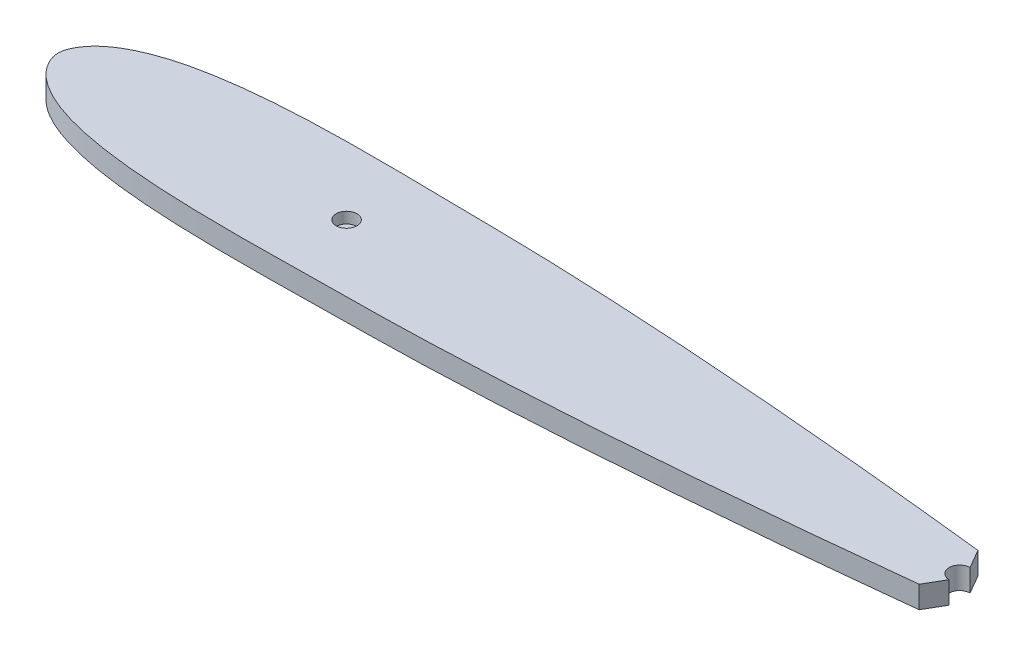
SolidWorks part; units mm, degrees
ref_plane "Front Plane" through (0, 0, 0) normal (0, 0, 1) x (1, 0, 0)
ref_plane "Top Plane" through (0, 0, 0) normal (0, 1, 0) x (1, 0, 0)
ref_plane "Right Plane" through (0, 0, 0) normal (1, 0, 0) x (0, 0, -1)
sketch "Sketch1" plane through (0, 0, 0) normal (0, 1, 0) x (1, 0, 0)
  line L0 (71.9303, -9.0513) -> (71.9519, -9.0647)
  spline S0 degree 3 poles (71.9303, -9.0513) (68.7966, -8.6196) (63.0003, -7.8147) (54.5308, -6.7346) (46.5307, -5.7653) (35.8673, -4.5512) (25.2004, -3.4392) (14.5302, -2.4363) (6.5301, -1.7484) (-1.4698, -1.1236) (-9.5232, -0.5726) (-17.5764, -0.1011) (-25.6304, 0.248) (-33.6309, 0.506) (-40.2465, 0.5015) (-45.5257, 0.6244) (-52.1392, 0.7165) (-60.1464, 0.7205) (-68.1529, 0.2977) (-73.2186, -0.2662) (-76.6922, -0.8358) (-79.361, -1.4431) (-81.4881, -2.0862) (-83.098, -2.6746) (-84.7173, -3.4124) (-86.3653, -4.3792) (-87.7324, -5.5098) (-88.9364, -7.0232) (-89.8227, -9.0595) (-88.9364, -11.0958) (-87.7324, -12.6092) (-86.3653, -13.7398) (-84.7173, -14.7066) (-83.098, -15.4444) (-81.4881, -16.0328) (-79.361, -16.6759) (-76.6922, -17.2832) (-73.2186, -17.8528) (-68.1529, -18.4167) (-60.1464, -18.8395) (-52.1392, -18.8355) (-45.5257, -18.7434) (-40.2465, -18.6205) (-33.6309, -18.625) (-25.6304, -18.367) (-17.5764, -18.0179) (-9.5232, -17.5464) (-1.4698, -16.9954) (6.5301, -16.3706) (14.5302, -15.6827) (25.2004, -14.6798) (35.8673, -13.5678) (46.5307, -12.3536) (54.5308, -11.3844) (63.0075, -10.3033) (68.8109, -9.4974) (71.9519, -9.0647) knots -0.004321 -0.004321 -0.004321 -0.004321 0.024634 0.049243 0.07383 0.098397 0.147479 0.171995 0.196494 0.220976 0.245442 0.27038 0.294813 0.319232 0.343642 0.35536 0.367566 0.404183 0.428636 0.44092 0.450818 0.460843 0.465946 0.471149 0.476523 0.482208 0.488618 0.492568 0.5 0.507432 0.511382 0.517792 0.523477 0.528851 0.534054 0.539157 0.549182 0.55908 0.571364 0.595817 0.632434 0.64464 0.656358 0.680768 0.705187 0.72962 0.754558 0.779024 0.803506 0.828005 0.852521 0.901603 0.92617 0.950757 0.975366 1.004387 1.004387 1.004387 1.004387
  point P0 (71.9303, -9.0513)
extrude "Boss-Extrude1" add sketch "Sketch1" along normal blind 3.175
sketch "Sketch2" plane through (0, 3.175, 0) normal (0, 1, 0) x (1, 0, 0)
  line L0 (71.9303, -9.0513) -> (-89.4725, -9.0513) construction
  circle A0 centre (39.9303, -9.0513) radius 1.5
  spline S0 degree 3 poles (71.9303, -9.0513) (68.7966, -8.6196) (63.0003, -7.8147) (54.5308, -6.7346) (46.5307, -5.7653) (35.8673, -4.5512) (25.2004, -3.4392) (14.5302, -2.4363) (6.5301, -1.7484) (-1.4698, -1.1236) (-9.5232, -0.5726) (-17.5764, -0.1011) (-25.6304, 0.248) (-33.6309, 0.506) (-40.2465, 0.5015) (-45.5257, 0.6244) (-52.1392, 0.7165) (-60.1464, 0.7205) (-68.1529, 0.2977) (-73.2186, -0.2662) (-76.6922, -0.8358) (-79.361, -1.4431) (-81.4881, -2.0862) (-83.098, -2.6746) (-84.7173, -3.4124) (-86.3653, -4.3792) (-87.7324, -5.5098) (-88.9364, -7.0232) (-89.8227, -9.0595) (-88.9364, -11.0958) (-87.7324, -12.6092) (-86.3653, -13.7398) (-84.7173, -14.7066) (-83.098, -15.4444) (-81.4881, -16.0328) (-79.361, -16.6759) (-76.6922, -17.2832) (-73.2186, -17.8528) (-68.1529, -18.4167) (-60.1464, -18.8395) (-52.1392, -18.8355) (-45.5257, -18.7434) (-40.2465, -18.6205) (-33.6309, -18.625) (-25.6304, -18.367) (-17.5764, -18.0179) (-9.5232, -17.5464) (-1.4698, -16.9954) (6.5301, -16.3706) (14.5302, -15.6827) (25.2004, -14.6798) (35.8673, -13.5678) (46.5307, -12.3536) (54.5308, -11.3844) (63.0075, -10.3033) (68.8109, -9.4974) (71.9519, -9.0647) knots -0.004321 -0.004321 -0.004321 -0.004321 0.024634 0.049243 0.07383 0.098397 0.147479 0.171995 0.196494 0.220976 0.245442 0.27038 0.294813 0.319232 0.343642 0.35536 0.367566 0.404183 0.428636 0.44092 0.450818 0.460843 0.465946 0.471149 0.476523 0.482208 0.488618 0.492568 0.5 0.507432 0.511382 0.517792 0.523477 0.528851 0.534054 0.539157 0.549182 0.55908 0.571364 0.595817 0.632434 0.64464 0.656358 0.680768 0.705187 0.72962 0.754558 0.779024 0.803506 0.828005 0.852521 0.901603 0.92617 0.950757 0.975366 1.004387 1.004387 1.004387 1.004387 construction
  dimension "D1" = 3
  dimension "D2" = 32
extrude "Cut-Extrude1" cut sketch "Sketch2" against normal blind 3.175
sketch "Sketch3" plane through (0, 3.175, 0) normal (0, 1, 0) x (1, 0, 0)
  line L0 (71.9519, -9.0647) -> (-89.4726, -9.0647) construction
  circle A0 centre (-48.0481, -9.0647) radius 1.5
  spline S0 degree 3 poles (71.9303, -9.0513) (68.7966, -8.6196) (63.0003, -7.8147) (54.5308, -6.7346) (46.5307, -5.7653) (35.8673, -4.5512) (25.2004, -3.4392) (14.5302, -2.4363) (6.5301, -1.7484) (-1.4698, -1.1236) (-9.5232, -0.5726) (-17.5764, -0.1011) (-25.6304, 0.248) (-33.6309, 0.506) (-40.2465, 0.5015) (-45.5257, 0.6244) (-52.1392, 0.7165) (-60.1464, 0.7205) (-68.1529, 0.2977) (-73.2186, -0.2662) (-76.6922, -0.8358) (-79.361, -1.4431) (-81.4881, -2.0862) (-83.098, -2.6746) (-84.7173, -3.4124) (-86.3653, -4.3792) (-87.7324, -5.5098) (-88.9364, -7.0232) (-89.8227, -9.0595) (-88.9364, -11.0958) (-87.7324, -12.6092) (-86.3653, -13.7398) (-84.7173, -14.7066) (-83.098, -15.4444) (-81.4881, -16.0328) (-79.361, -16.6759) (-76.6922, -17.2832) (-73.2186, -17.8528) (-68.1529, -18.4167) (-60.1464, -18.8395) (-52.1392, -18.8355) (-45.5257, -18.7434) (-40.2465, -18.6205) (-33.6309, -18.625) (-25.6304, -18.367) (-17.5764, -18.0179) (-9.5232, -17.5464) (-1.4698, -16.9954) (6.5301, -16.3706) (14.5302, -15.6827) (25.2004, -14.6798) (35.8673, -13.5678) (46.5307, -12.3536) (54.5308, -11.3844) (63.0075, -10.3033) (68.8109, -9.4974) (71.9519, -9.0647) knots -0.004321 -0.004321 -0.004321 -0.004321 0.024634 0.049243 0.07383 0.098397 0.147479 0.171995 0.196494 0.220976 0.245442 0.27038 0.294813 0.319232 0.343642 0.35536 0.367566 0.404183 0.428636 0.44092 0.450818 0.460843 0.465946 0.471149 0.476523 0.482208 0.488618 0.492568 0.5 0.507432 0.511382 0.517792 0.523477 0.528851 0.534054 0.539157 0.549182 0.55908 0.571364 0.595817 0.632434 0.64464 0.656358 0.680768 0.705187 0.72962 0.754558 0.779024 0.803506 0.828005 0.852521 0.901603 0.92617 0.950757 0.975366 1.004387 1.004387 1.004387 1.004387 construction
  dimension "D2" = 3
  dimension "D1" = 120
extrude "Cut-Extrude2" cut sketch "Sketch3" against normal blind 1.5875
sketch "Sketch4" plane through (0, 0, 0) normal (0, -1, 0) x (1, 0, 0)
  line L0 (71.9303, 9.0513) -> (-89.4725, 9.0513) construction
  circle A0 centre (-73.2697, 9.0513) radius 1.5
  circle A1 centre (39.9303, 9.0513) radius 1.5 construction
  spline S0 degree 3 poles (71.9303, 9.0513) (68.7966, 8.6196) (63.0003, 7.8147) (54.5308, 6.7346) (46.5307, 5.7653) (35.8673, 4.5512) (25.2004, 3.4392) (14.5302, 2.4363) (6.5301, 1.7484) (-1.4698, 1.1236) (-9.5232, 0.5726) (-17.5764, 0.1011) (-25.6304, -0.248) (-33.6309, -0.506) (-40.2465, -0.5015) (-45.5257, -0.6244) (-52.1392, -0.7165) (-60.1464, -0.7205) (-68.1529, -0.2977) (-73.2186, 0.2662) (-76.6922, 0.8358) (-79.361, 1.4431) (-81.4881, 2.0862) (-83.098, 2.6746) (-84.7173, 3.4124) (-86.3653, 4.3792) (-87.7324, 5.5098) (-88.9364, 7.0232) (-89.8227, 9.0595) (-88.9364, 11.0958) (-87.7324, 12.6092) (-86.3653, 13.7398) (-84.7173, 14.7066) (-83.098, 15.4444) (-81.4881, 16.0328) (-79.361, 16.6759) (-76.6922, 17.2832) (-73.2186, 17.8528) (-68.1529, 18.4167) (-60.1464, 18.8395) (-52.1392, 18.8355) (-45.5257, 18.7434) (-40.2465, 18.6205) (-33.6309, 18.625) (-25.6304, 18.367) (-17.5764, 18.0179) (-9.5232, 17.5464) (-1.4698, 16.9954) (6.5301, 16.3706) (14.5302, 15.6827) (25.2004, 14.6798) (35.8673, 13.5678) (46.5307, 12.3536) (54.5308, 11.3844) (63.0075, 10.3033) (68.8109, 9.4974) (71.9519, 9.0647) knots -0.004321 -0.004321 -0.004321 -0.004321 0.024634 0.049243 0.07383 0.098397 0.147479 0.171995 0.196494 0.220976 0.245442 0.27038 0.294813 0.319232 0.343642 0.35536 0.367566 0.404183 0.428636 0.44092 0.450818 0.460843 0.465946 0.471149 0.476523 0.482208 0.488618 0.492568 0.5 0.507432 0.511382 0.517792 0.523477 0.528851 0.534054 0.539157 0.549182 0.55908 0.571364 0.595817 0.632434 0.64464 0.656358 0.680768 0.705187 0.72962 0.754558 0.779024 0.803506 0.828005 0.852521 0.901603 0.92617 0.950757 0.975366 1.004387 1.004387 1.004387 1.004387 construction
  dimension "D2" = 3
  dimension "D1" = 113.2
extrude "Cut-Extrude3" cut sketch "Sketch4" against normal blind 1.5875
sketch "Sketch5" plane through (0, 3.175, 0) normal (0, 1, 0) x (1, 0, 0)
  line L0 (39.9303, -5.0187) -> (39.9303, -7.5513)
  line L1 (71.9519, -9.0647) -> (71.9303, -9.0513)
  line L2 (71.9519, -9.0647) -> (71.9303, -9.0513)
  line L3 (39.9303, -10.5513) -> (39.9303, -13.1003)
  circle A0 centre (39.9303, -9.0513) radius 1.5 construction
  arc A1 (39.9303, -10.5513) -> (39.9303, -7.5513) centre (39.9303, -9.0513) ccw
  spline S0 degree 3 poles (39.9303, -13.1003) (42.1301, -12.8544) (46.9978, -12.297) (54.5308, -11.3844) (63.0075, -10.3033) (68.8109, -9.4974) (71.9519, -9.0647) knots 0.90591 0.90591 0.90591 0.90591 0.92617 0.950757 0.975366 1.004387 1.004387 1.004387 1.004387
  spline S1 degree 3 poles (1625.9048, 6779.2147) (480.6512, -153.4224) (274.9902, -34.8506) (54.5308, -6.7346) (46.5307, -5.7653) (35.8673, -4.5512) (25.2004, -3.4392) (14.5302, -2.4363) (6.5301, -1.7484) (-1.4698, -1.1236) (-9.5232, -0.5726) (-17.5764, -0.1011) (-25.6304, 0.248) (-33.6309, 0.506) (-40.2465, 0.5015) (-45.5257, 0.6244) (-52.1392, 0.7165) (-60.1464, 0.7205) (-68.1529, 0.2977) (-73.2186, -0.2662) (-76.6922, -0.8358) (-79.361, -1.4431) (-81.4881, -2.0862) (-83.098, -2.6746) (-84.7173, -3.4124) (-86.3653, -4.3792) (-87.7324, -5.5098) (-88.9364, -7.0232) (-89.8227, -9.0595) (-88.9364, -11.0958) (-87.7324, -12.6092) (-86.3653, -13.7398) (-84.7173, -14.7066) (-83.098, -15.4444) (-81.4881, -16.0328) (-79.361, -16.6759) (-76.6922, -17.2832) (-73.2186, -17.8528) (-68.1529, -18.4167) (-60.1464, -18.8395) (-52.1392, -18.8355) (-45.5257, -18.7434) (-40.2465, -18.6205) (-33.6309, -18.625) (-25.6304, -18.367) (-17.5764, -18.0179) (-9.5232, -17.5464) (-1.4698, -16.9954) (6.5301, -16.3706) (14.5302, -15.6827) (25.2004, -14.6798) (35.8673, -13.5678) (46.5307, -12.3536) (54.5308, -11.3844) (274.9897, 16.7315) (480.6503, 135.3029) (1625.8974, -6797.2888) knots -1.960421 -1.960421 -1.960421 -1.960421 0.024634 0.049243 0.07383 0.098397 0.147479 0.171995 0.196494 0.220976 0.245442 0.27038 0.294813 0.319232 0.343642 0.35536 0.367566 0.404183 0.428636 0.44092 0.450818 0.460843 0.465946 0.471149 0.476523 0.482208 0.488618 0.492568 0.5 0.507432 0.511382 0.517792 0.523477 0.528851 0.534054 0.539157 0.549182 0.55908 0.571364 0.595817 0.632434 0.64464 0.656358 0.680768 0.705187 0.72962 0.754558 0.779024 0.803506 0.828005 0.852521 0.901603 0.92617 0.950757 0.975366 2.960417 2.960417 2.960417 2.960417 only from (71.9303, -9.0513) to (71.9519, -9.0647)
  spline S2 degree 3 poles (71.9303, -9.0513) (68.7966, -8.6196) (63.0003, -7.8147) (54.5308, -6.7346) (46.9978, -5.8219) (42.1301, -5.2646) (39.9303, -5.0187) knots -0.004321 -0.004321 -0.004321 -0.004321 0.024634 0.049243 0.07383 0.09409 0.09409 0.09409 0.09409
  dimension "D1" = 0
extrude "Cut-Extrude4" cut sketch "Sketch5" against normal through all both and the other way through all
sketch "Sketch6" plane through (0, 3.175, 0) normal (0, 1, 0) x (1, 0, 0)
  line L0 (39.9303, -7.5513) -> (38.3678, -4.845)
  line L1 (39.9303, -10.5513) -> (38.3577, -13.2751)
  line L2 (39.9303, -10.5513) -> (39.9303, -13.1003) construction
  line L3 (39.9303, -5.0186) -> (39.9303, -7.5513) construction
  line L6 (39.9303, -13.1003) -> (39.9303, -10.5513)
  line L7 (39.9303, -7.5513) -> (39.9303, -5.0186)
  line L8 (39.9303, -13.1003) -> (39.9303, -10.5513)
  line L9 (39.9303, -7.5513) -> (39.9303, -5.0186)
  arc A1 (39.9303, -7.5513) -> (39.9303, -10.5513) centre (39.9303, -9.0513) ccw
  spline S0 degree 3 poles (38.3577, -13.2751) (38.882, -13.2172) (39.4062, -13.1589) (39.9303, -13.1003) knots 0.901082 0.901082 0.901082 0.901082 0.90591 0.90591 0.90591 0.90591
  spline S1 degree 3 poles (315.0895, -6843.0038) (934.7995, -360.7556) (495.6659, -52.4845) (25.2002, -3.4391) (14.5299, -2.4362) (6.5296, -1.7483) (-1.4704, -1.1235) (-9.5239, -0.5725) (-17.5772, -0.1009) (-25.6313, 0.2482) (-33.6319, 0.5061) (-40.2476, 0.5016) (-45.5269, 0.6246) (-52.1405, 0.7167) (-60.1478, 0.7207) (-68.1544, 0.2979) (-73.2202, -0.2661) (-76.6939, -0.8356) (-79.3627, -1.443) (-81.4898, -2.0861) (-83.0997, -2.6745) (-84.7191, -3.4123) (-86.3671, -4.3791) (-87.7342, -5.5097) (-88.9383, -7.0232) (-89.8245, -9.0595) (-88.9383, -11.0958) (-87.7342, -12.6092) (-86.3671, -13.7399) (-84.7191, -14.7066) (-83.0997, -15.4445) (-81.4898, -16.0329) (-79.3627, -16.676) (-76.6939, -17.2833) (-73.2202, -17.8529) (-68.1544, -18.4168) (-60.1478, -18.8397) (-52.1405, -18.8356) (-45.5269, -18.7435) (-40.2476, -18.6206) (-33.6319, -18.6251) (-25.6313, -18.3671) (-17.5772, -18.018) (-9.5239, -17.5465) (-1.4704, -16.9955) (6.5296, -16.3707) (14.5299, -15.6828) (25.2002, -14.6798) (495.6698, 34.366) (934.8068, 342.6417) (315.0741, 6825.0488) knots -4.157513 -4.157513 -4.157513 -4.157513 0.098397 0.147479 0.171995 0.196494 0.220976 0.245442 0.27038 0.294813 0.319232 0.343642 0.35536 0.367566 0.404183 0.428636 0.44092 0.450818 0.460843 0.465946 0.471149 0.476523 0.482208 0.488618 0.492568 0.5 0.507432 0.511382 0.517792 0.523477 0.528851 0.534054 0.539157 0.549182 0.55908 0.571364 0.595817 0.632434 0.64464 0.656358 0.680768 0.705187 0.72962 0.754558 0.779024 0.803506 0.828005 0.852521 0.901603 5.157549 5.157549 5.157549 5.157549 only from (39.9303, -5.0186) to (39.9303, -13.1003)
  spline S2 degree 3 poles (39.9303, -5.0186) (39.4095, -4.9604) (38.8887, -4.9025) (38.3678, -4.845) knots 0.09409 0.09409 0.09409 0.09409 0.098887 0.098887 0.098887 0.098887
  dimension "D1" = 30
  dimension "D2" = 30
  dimension "D3" = 0
extrude "Cut-Extrude5" cut sketch "Sketch6" against normal through all both and the other way through all
